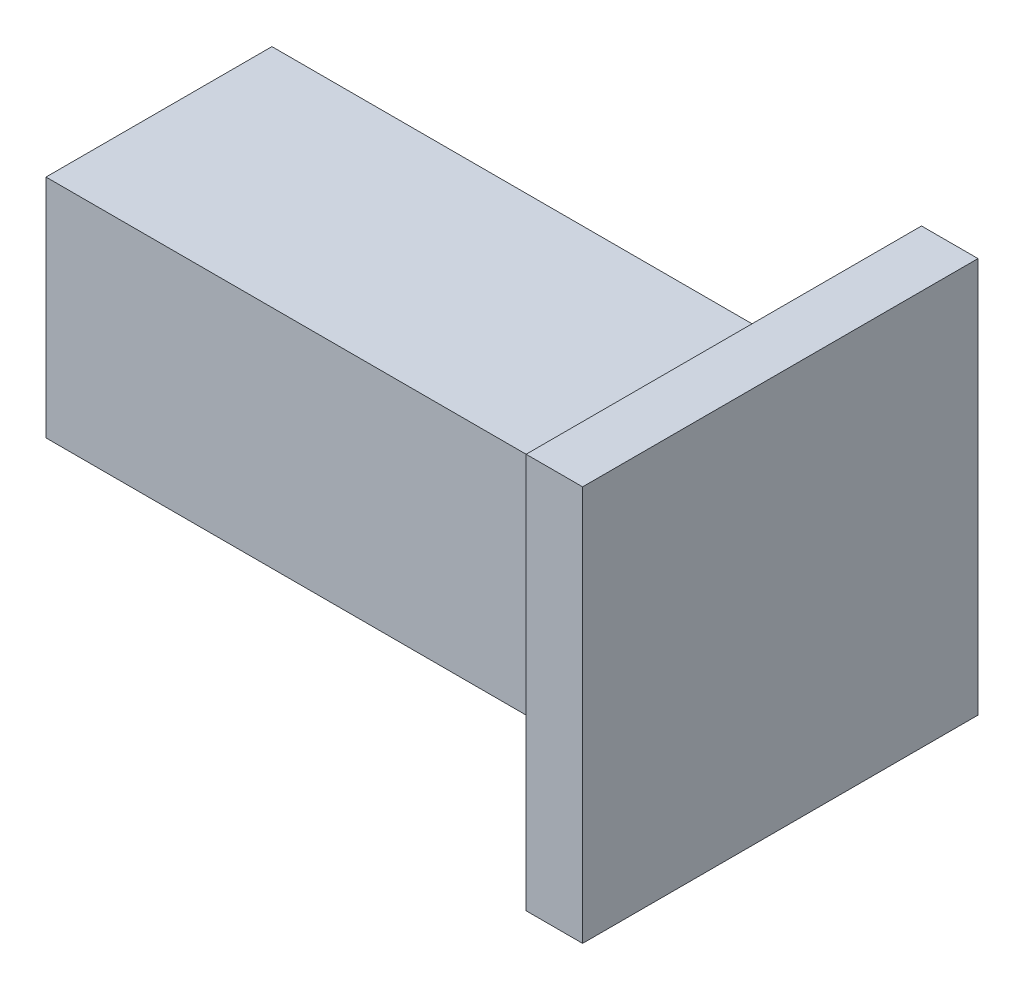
SolidWorks part; units mm, degrees
ref_plane "Ebene vorne" through (0, 0, 0) normal (0, 0, 1) x (1, 0, 0)
ref_plane "Ebene oben" through (0, 0, 0) normal (0, 1, 0) x (1, 0, 0)
ref_plane "Ebene rechts" through (0, 0, 0) normal (1, 0, 0) x (0, 0, -1)
sketch "Skizze1" plane through (0, 0, 0) normal (0, 0, 1) x (1, 0, 0)
  line L0 (-10, -35) -> (100, -35) construction
  line L1 (0, -15) -> (0, -55)
  line L5 (0, -15) -> (100, -15)
  line L7 (0, -55) -> (100, -55)
  line L8 (100, -15) -> (100, -55)
  dimension "D3" = 40
extrude "Aufsatz-Linear austragen1" add sketch "Skizze1" along normal blind 40
sketch "Skizze2" plane through (100, 0, 0) normal (1, 0, 0) x (0, 0, -1)
  line L0 (-40, -15) -> (-40, -55) construction
  line L1 (-55, 0) -> (15, 0)
  line L2 (-55, 0) -> (-55, -70)
  line L3 (-55, -70) -> (15, -70)
  line L4 (15, 0) -> (15, -70)
  line L5 (-40, -15) -> (0, -15) construction
  dimension "D1" = 70
  dimension "D2" = 70
  dimension "D3" = 15
  dimension "D4" = 15
extrude "Aufsatz-Linear austragen2" add sketch "Skizze2" along normal blind 10
fillet "Verrundung1" radius 3 4 edges at (100, -15, 20) (100, -35, 0) (100, -55, 20) (100, -35, 40)
